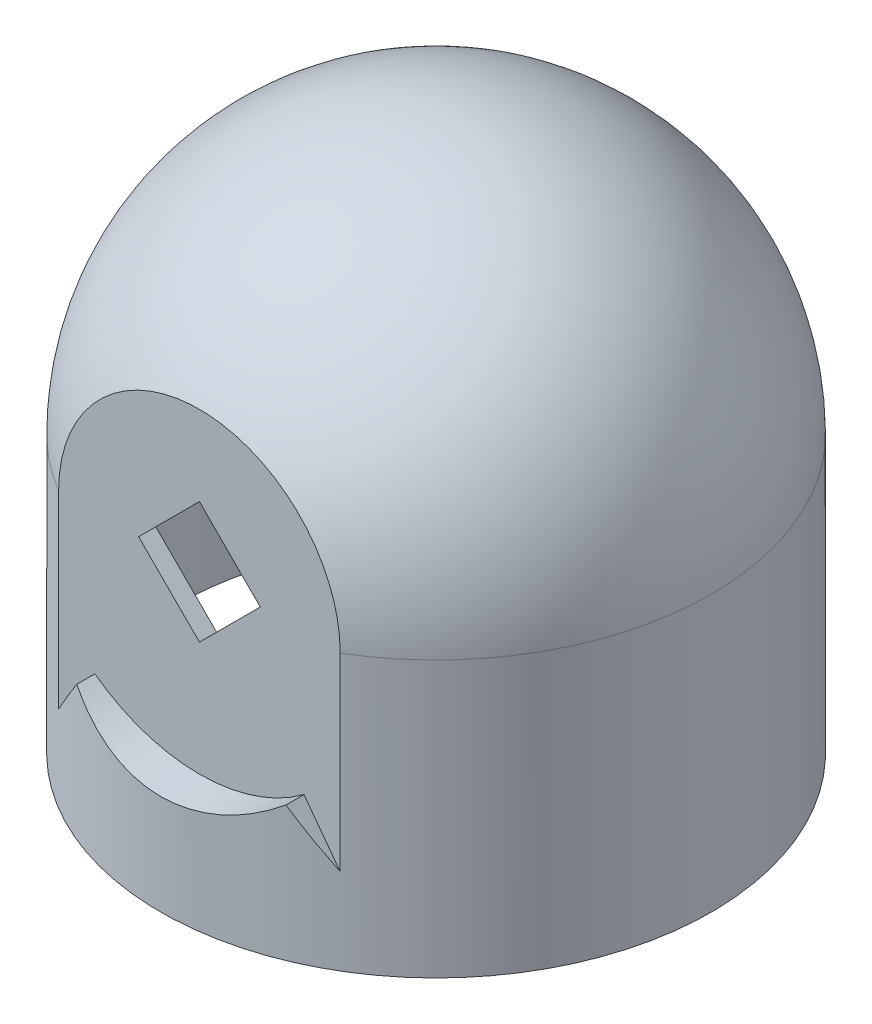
SolidWorks part; units mm, degrees
ref_plane "Front Plane" through (0, 0, 0) normal (0, 0, 1) x (1, 0, 0)
ref_plane "Top Plane" through (0, 0, 0) normal (0, 1, 0) x (1, 0, 0)
ref_plane "Right Plane" through (0, 0, 0) normal (1, 0, 0) x (0, 0, -1)
sketch "Sketch1" plane through (0, 0, 0) normal (0, 0, -1) x (-1, 0, 0)
  line L0 (0, 0) -> (0, 32) construction
  line L1 (0, 0) -> (16, 0)
  line L2 (16, 0) -> (16, 16)
  line L3 (0, 0) -> (0, 32)
  arc A0 (16, 16) -> (0, 32) centre (0, 16) ccw
  dimension "D1" = 32
  dimension "D2" = 32
revolve "Revolve1" add sketch "Sketch1" angle 180 about L3
ref_plane "Plane1" through (0, 0, 13.75) normal (0, 0, 1) x (1, 0, 0)
sketch "Sketch2" plane through (0, 0, 13.75) normal (0, 0, 1) x (1, 0, 0)
  line L0 (8.1815, 0) -> (8.1815, 16)
  line L1 (8.1815, 5) -> (8.1815, 16)
  line L2 (-8.1815, 16) -> (-8.1815, 0)
  line L3 (-8.1815, 16) -> (-8.1815, 5)
  line L5 (-8.1815, 5) -> (8.1815, 5)
  line L6 (-16, 0) -> (16, 0) construction
  line L7 (-19.1945, 16) -> (21.0773, 16) construction
  arc A0 (8.1815, 16) -> (-8.1815, 16) centre (0, 16) ccw
  arc A1 (8.1815, 16) -> (-8.1815, 16) centre (0, 16) ccw
  dimension "D1" = 5
extrude "Cut-Extrude1" cut sketch "Sketch2" along normal through all
shell "Shell1" thickness 1
sketch "Sketch3" plane through (0, 0, 13.75) normal (0, 0, 1) x (1, 0, 0)
  line L0 (-8.1815, 5) -> (0, 16) construction
  line L1 (6.0763, 7.8304) -> (8.1815, 5)
  line L2 (-8.1815, 5) -> (-6.0763, 7.8304)
  line L4 (8.1815, 5) -> (-8.1815, 5)
  line L5 (0, 16) -> (8.1815, 5) construction
  arc A1 (8.1815, 16) -> (-8.1815, 16) centre (0, 16) ccw construction
  arc A2 (8.1815, 16) -> (-8.1815, 16) centre (0, 16) cw construction
  arc A3 (-6.0763, 7.8304) -> (6.0763, 7.8304) centre (0, 16) ccw
  dimension "D1" = 2
extrude "Extrude1" add sketch "Sketch3" along normal up to surface
sketch "Sketch4" plane through (0, 0, 13.75) normal (0, 0, 1) x (1, 0, 0)
  line L0 (-3.5355, 16) -> (0, 12.4645)
  line L1 (-3.5355, 16) -> (0, 19.5355)
  line L2 (0, 12.4645) -> (3.5355, 16)
  line L3 (0, 19.5355) -> (3.5355, 16)
  line L4 (-3.5355, 16) -> (3.5355, 16) construction
  arc A0 (8.1815, 16) -> (-8.1815, 16) centre (0, 16) ccw construction
  point P0 (0, 16)
  dimension "D1" = 5
extrude "Cut-Extrude2" cut sketch "Sketch4" against normal up to next
mirror "Mirror1"
sketch "Sketch5" plane through (0, 0, 0) normal (0, -1, 0) x (1, 0, 0)
  circle A0 centre (0, 0) radius 5.5
  dimension "D1" = 11
extrude "Extrude-Thin1" add sketch "Sketch5" against normal up to surface (18.3091 mm away) thin
